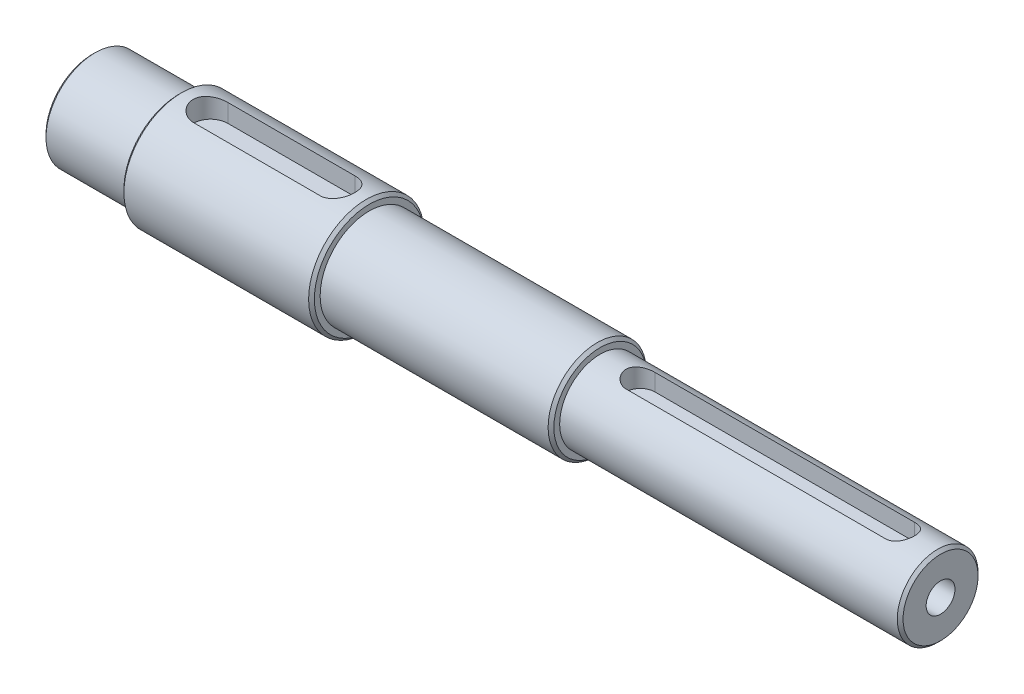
SolidWorks part; units mm, degrees
ref_plane "Front Plane" through (0, 0, 0) normal (0, 0, 1) x (1, 0, 0)
ref_plane "Top Plane" through (0, 0, 0) normal (0, 1, 0) x (1, 0, 0)
ref_plane "Right Plane" through (0, 0, 0) normal (1, 0, 0) x (0, 0, -1)
sketch "Sketch1" plane through (0, 0, 0) normal (0, 0, 1) x (1, 0, 0)
  line L0 (-85.9027, 0) -> (85.9027, 0) construction
  line L1 (-78.2301, 0) -> (-78.2301, 8.5)
  line L2 (-78.2301, 8.5) -> (-63.2301, 8.5)
  line L3 (-63.2301, 8.5) -> (-63.2301, 10)
  line L4 (-63.2301, 10) -> (-30.2301, 10)
  line L5 (-30.2301, 10) -> (-30.2301, 8.5)
  line L6 (-30.2301, 8.5) -> (9.7699, 8.5)
  line L7 (9.7699, 8.5) -> (9.7699, 7)
  line L8 (9.7699, 7) -> (68.7699, 7)
  line L9 (68.7699, 7) -> (68.7699, 0)
  line L10 (-78.2301, 0) -> (68.7699, 0)
  point P4 (0, 0)
  dimension "D1" = 8.5
  dimension "D2" = 1.5
  dimension "D3" = 33
  dimension "D4" = 147
  dimension "D5" = 59
  dimension "D6" = 15
  dimension "D7" = 7
revolve "Revolve1" add sketch "Sketch1" angle 360 about L0
ref_plane "Plane1" through (0, 6.4, 0) normal (0, 1, 0) x (1, 0, 0)
sketch "Sketch2" plane through (0, 6.4, 0) normal (0, 1, 0) x (1, 0, 0)
  line L0 (-57.7301, 3) -> (-35.7301, 3)
  line L2 (-35.7301, -3) -> (-57.7301, -3)
  line L3 (-63.2301, 8.5) -> (-63.2301, -8.5) construction
  arc A0 (-57.7301, 3) -> (-57.7301, -3) centre (-57.7301, 0) ccw
  arc A1 (-35.7301, -3) -> (-35.7301, 3) centre (-35.7301, 0) ccw
  point P1 (-46.7301, -3)
  dimension "D1" = 22
  dimension "D2" = 16.5
extrude "Cut-Extrude1" cut sketch "Sketch2" along normal blind 10 contours L2 A1 L0 A0
ref_plane "Plane2" through (0, 3.6, 0) normal (0, 1, 0) x (1, 0, 0)
sketch "Sketch3" plane through (0, 3.6, 0) normal (0, 1, 0) x (1, 0, 0)
  line L0 (16.7699, 2.5) -> (61.7699, 2.5)
  line L1 (16.7699, -2.5) -> (61.7699, -2.5)
  line L2 (68.7699, -7) -> (68.7699, 7) construction
  arc A0 (61.7699, -2.5) -> (61.7699, 2.5) centre (61.7699, 0) ccw
  arc A1 (16.7699, 2.5) -> (16.7699, -2.5) centre (16.7699, 0) ccw
  point P8 (39.2699, -2.5)
  dimension "D1" = 45
  dimension "D2" = 29.5
extrude "Cut-Extrude2" cut sketch "Sketch3" along normal blind 10
chamfer "Chamfer1" distance 0.5 angle 45 5 edges at (68.7699, 0, 7) (9.7699, 0, 8.5) (-30.2301, 0, 10) (-63.2301, 0, 10) (-78.2301, 0, 8.5)
hole_wizard "M6 Tapped Hole1" positions "Sketch4" profile "Sketch5" tap size "M6" standard "DIN"
sketch "Sketch4" plane through (68.7699, 0, 0) normal (1, 0, 0) x (0, 0, -1)
  point P0 (0, 0)
sketch "Sketch5" plane through (68.7699, 0, 0) normal (0, 1, 0) x (0, 0, -1)
  line L0 (0, 0) -> (0, 16.5022)
  line L1 (0, 16.5022) -> (2.5, 15)
  line L2 (2.5, 15) -> (2.5, 0)
  line L5 (2.5, 0) -> (0, 0)
  line L10 (0, 16.5022) -> (-2.5, 15) construction
  line L11 (0, -6.35) -> (0, 107.95) construction
  dimension "Tap Drill Dia." = 5
  dimension "Tap Drill Depth" = 15
  dimension "Drill Angle" = 118
